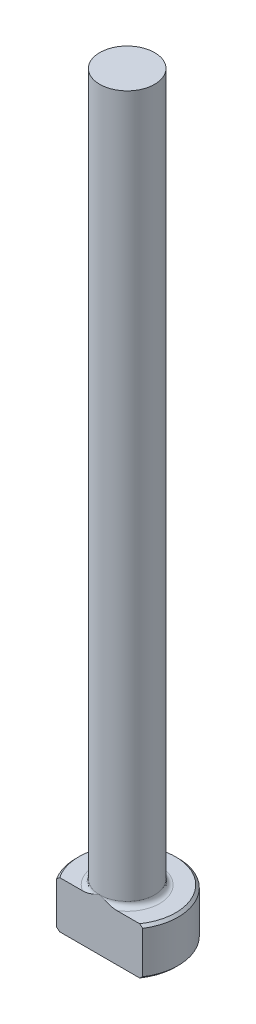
SolidWorks part; units mm, degrees
ref_plane "Front Plane" through (0, 0, 0) normal (0, 0, 1) x (1, 0, 0)
ref_plane "Top Plane" through (0, 0, 0) normal (0, 1, 0) x (1, 0, 0)
ref_plane "Right Plane" through (0, 0, 0) normal (1, 0, 0) x (0, 0, -1)
sketch "Sketch1" plane through (0, 0, 0) normal (0, 0, 1) x (1, 0, 0)
  line L0 (0, 259.9588) -> (0, -15.1925) construction
  line L1 (0, 0) -> (-5.1562, 0)
  line L2 (-5.1562, 0) -> (-5.1562, 4.7498)
  line L3 (-5.1562, 4.7498) -> (-2.7775, 4.7498)
  line L4 (-2.7775, 4.7498) -> (-2.7775, 76.2)
  line L5 (-2.7775, 76.2) -> (0, 76.2)
  line L6 (0, 76.2) -> (0, 0)
  dimension "L" = 76.2
  dimension "H" = 10.3124
  dimension "T" = 4.7498
  dimension "D" = 5.555
revolve "Revolve1" add sketch "Sketch1" angle 360 about L0
chamfer "Chamfer1" distance 0.254 angle 45 2 edges at (0, 4.7498, 5.1562) (0, 0, 5.1562)
fillet "Fillet1" radius 0.508 1 edges at (0, 4.7498, 2.7775)
sketch "Sketch2" plane through (0, 0, 0) normal (0, 1, 0) x (1, 0, 0)
  line L0 (-4.3442, -2.7775) -> (4.3442, -2.7775)
  circle A0 centre (0, 0) radius 5.1562 construction
  arc A1 (-4.3442, -2.7775) -> (4.3442, -2.7775) centre (0, 0) ccw
  circle A3 centre (0, 0) radius 2.7775 construction
  dimension "D1" = 0
extrude "Key" cut sketch "Sketch2" along normal through all
sketch "Pocket Sketch" plane through (0, 0, 0) normal (0, 0, 1) x (1, 0, 0)
  line L0 (-5.5531, 0) -> (-5.5531, 4.7752)
  line L1 (-5.5531, 4.7752) -> (-3.7379, 4.7752)
  line L2 (-2.9759, 5.5372) -> (-2.9759, 22.225)
  line L3 (-2.9759, 22.225) -> (0, 22.225)
  line L4 (0, 22.225) -> (0, 0)
  line L5 (0, 0) -> (-5.5531, 0)
  line L6 (0, 12.6104) -> (0, -2.4989) construction
  line L7 (-5.1562, 4.4958) -> (-5.1562, 0.254) construction
  line L8 (4.9022, 4.7498) -> (-4.9022, 4.7498) construction
  line L9 (-2.7775, 76.2) -> (-2.7775, 5.2578) construction
  line L10 (-3.7379, 4.7752) -> (-2.9759, 5.5372)
  point P3 (-2.9759, 4.7752)
  dimension "D1" = 11.1061
  dimension "D2" = 0.3969
  dimension "D3" = 0.0254
  dimension "D4" = 0.1984
  dimension "D5" = 5.9519
  dimension "D6" = 22.225
